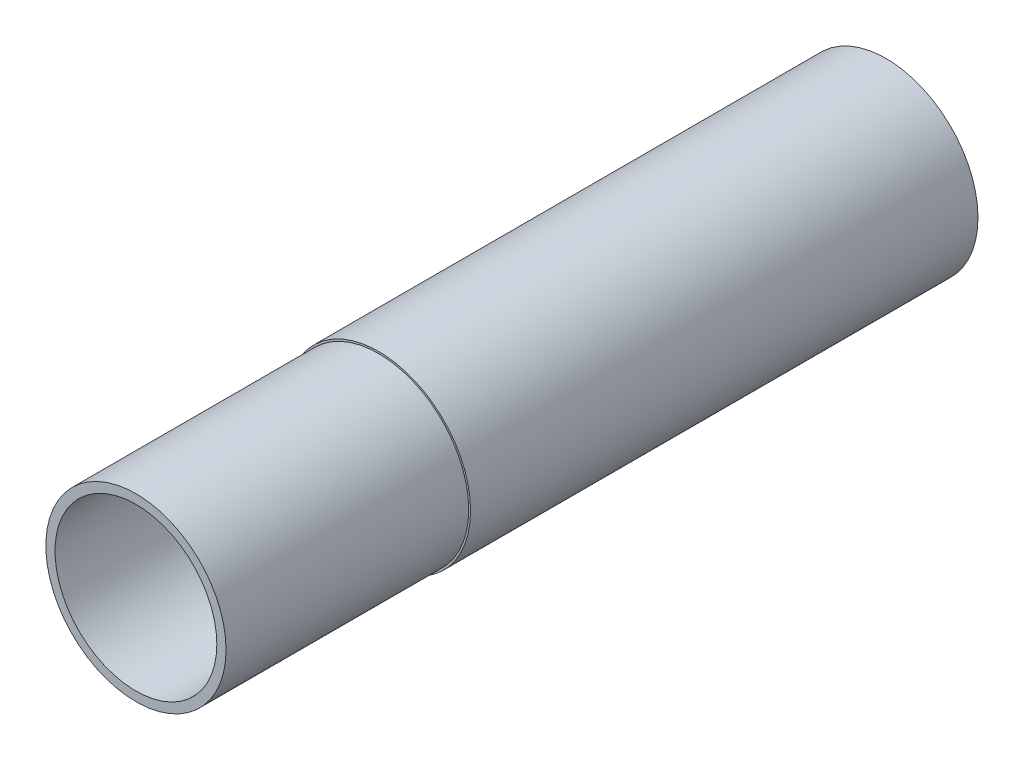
SolidWorks part; units mm, degrees
ref_plane "Plan de face" through (0, 0, 0) normal (0, 0, 1) x (1, 0, 0)
ref_plane "Plan de dessus" through (0, 0, 0) normal (0, 1, 0) x (1, 0, 0)
ref_plane "Plan de droite" through (0, 0, 0) normal (1, 0, 0) x (0, 0, -1)
sketch "Esquisse1" plane through (0, 0, 0) normal (0, 0, 1) x (1, 0, 0)
  circle A0 centre (0, 0) radius 12.5
  circle A1 centre (0, 0) radius 11
  dimension "D1" = 25
  dimension "D2" = 22
extrude "Boss.-Extru.1" add sketch "Esquisse1" along normal blind 102
sketch "Esquisse2" plane through (0, 0, 102) normal (0, 0, 1) x (1, 0, 0)
  circle A0 centre (0, 0) radius 12.25
  circle A1 centre (0, 0) radius 12.5
  dimension "D1" = 25
  dimension "D2" = 24.5
extrude "Enlèv. mat.-Extru.1" cut sketch "Esquisse2" against normal blind 33
